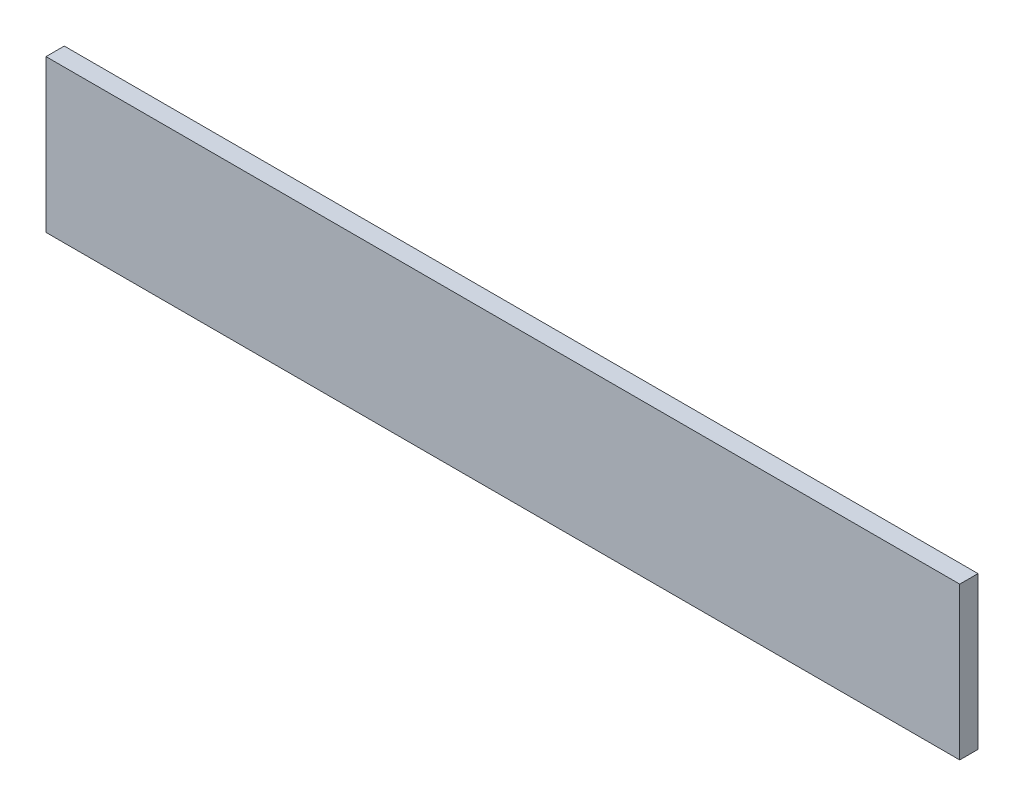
SolidWorks part; units mm, degrees
ref_plane "Front Plane" through (0, 0, 0) normal (0, 0, 1) x (1, 0, 0)
ref_plane "Top Plane" through (0, 0, 0) normal (0, 1, 0) x (1, 0, 0)
ref_plane "Right Plane" through (0, 0, 0) normal (1, 0, 0) x (0, 0, -1)
sketch "Sketch1" plane through (0, 0, 0) normal (0, 0, 1) x (1, 0, 0)
  line L1 (-150, 50) -> (150, 50)
  line L2 (-150, 50) -> (-150, 0)
  line L3 (-150, 0) -> (150, 0)
  line L4 (150, 50) -> (150, 0)
  dimension "D1" = 300
  dimension "D2" = 50
extrude "Extrude1" add sketch "Sketch1" along normal blind 6
